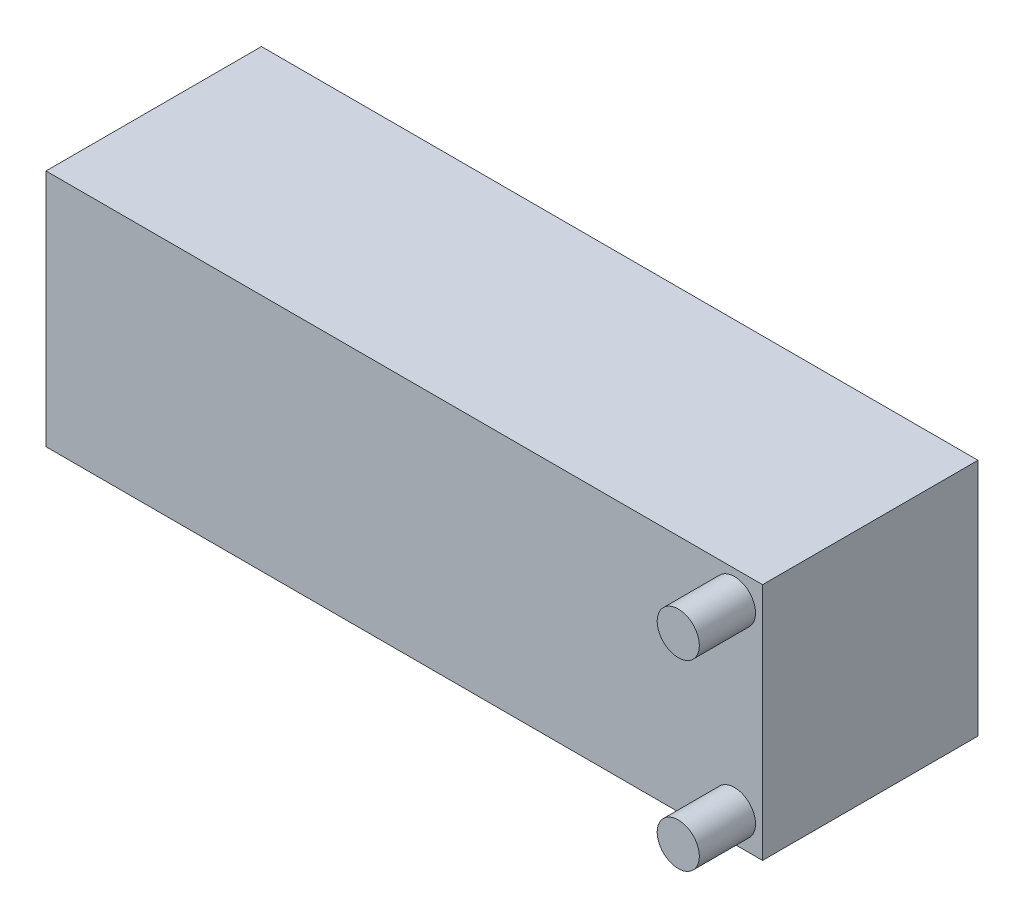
SolidWorks part; units mm, degrees
ref_plane "Front Plane" through (0, 0, 0) normal (0, 0, 1) x (1, 0, 0)
ref_plane "Top Plane" through (0, 0, 0) normal (0, 1, 0) x (1, 0, 0)
ref_plane "Right Plane" through (0, 0, 0) normal (1, 0, 0) x (0, 0, -1)
sketch "Sketch1" plane through (0, 0, 0) normal (0, 1, 0) x (1, 0, 0)
  line L1 (0, 0) -> (153, 0)
  line L2 (0, 0) -> (0, 46)
  line L3 (0, 46) -> (153, 46)
  line L4 (153, 0) -> (153, 46)
  dimension "D1" = 153
  dimension "D2" = 46
extrude "Boss-Extrude1" add sketch "Sketch1" along normal blind 51
sketch "Sketch2" plane through (0, 0, 0) normal (0, 0, 1) x (1, 0, 0)
  line L0 (153, 51) -> (153, 0) construction
  line L1 (0, 51) -> (153, 51) construction
  circle A0 centre (147, 45) radius 4.5
  circle A1 centre (147, 6) radius 4.5
  dimension "D2" = 9
  dimension "D3" = 6
  dimension "D1" = 6
  dimension "D4" = 2
extrude "Boss-Extrude2" add sketch "Sketch2" along normal blind 12
